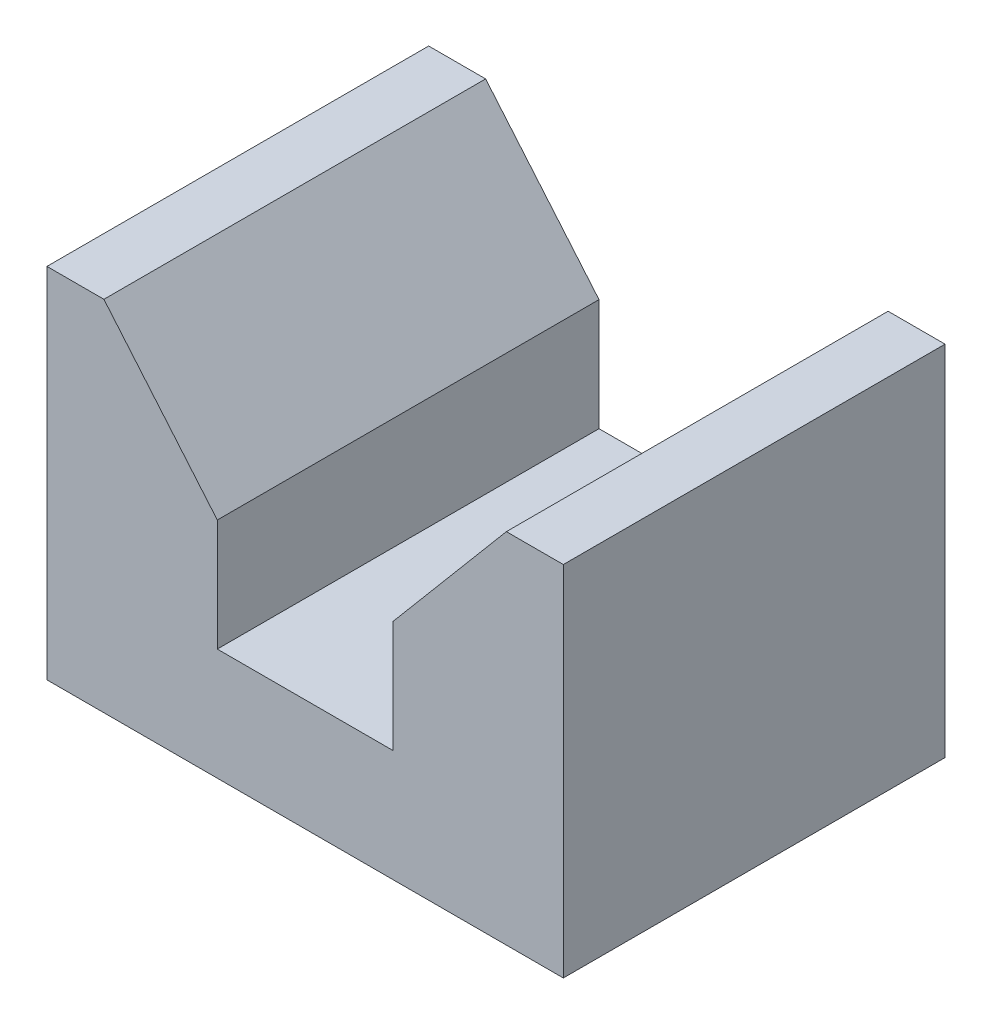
SolidWorks part; units mm, degrees
ref_plane "Front" through (0, 0, 0) normal (0, 0, 1) x (1, 0, 0)
ref_plane "Top" through (0, 0, 0) normal (0, 1, 0) x (1, 0, 0)
ref_plane "Right" through (0, 0, 0) normal (1, 0, 0) x (0, 0, -1)
sketch "Sketch1" plane through (0, 0, 0) normal (0, 0, 1) x (1, 0, 0)
  line L0 (0, 0) -> (0, 63.4573) construction
  line L1 (40.5822, 0) -> (-40.5822, 0)
  line L2 (-40.5822, 0) -> (-40.5822, 56.2831)
  line L3 (40.5822, 0) -> (40.5822, 56.2831)
  line L4 (-40.5822, 56.2831) -> (-31.6283, 56.2831)
  line L5 (40.5822, 56.2831) -> (31.6283, 56.2831)
  line L6 (-31.6283, 56.2831) -> (-13.8067, 35.1469)
  line L7 (31.6283, 56.2831) -> (13.8067, 35.1469)
  line L9 (-13.8067, 35.1469) -> (-13.8067, 17.5795)
  line L10 (-13.8067, 17.5795) -> (13.8067, 17.5795)
  line L11 (13.8067, 35.1469) -> (13.8067, 17.5795)
  point P10 (0, -7.0948)
  point P16 (0, 17.5795)
  dimension "D1" = 56.2831
  dimension "D3" = 81.1644
  dimension "D4" = 8.9539
extrude "Extrude1" add sketch "Sketch1" along normal mid plane 60
